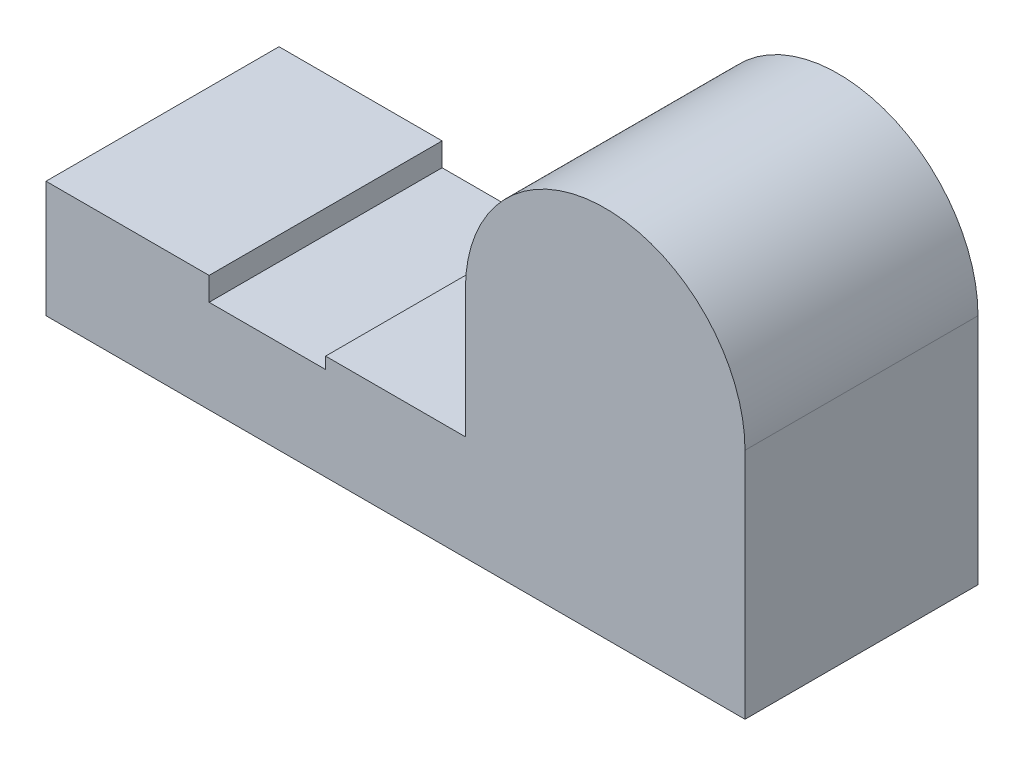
SolidWorks part; units mm, degrees
ref_plane "Front Plane" through (0, 0, 0) normal (0, 0, 1) x (1, 0, 0)
ref_plane "Top Plane" through (0, 0, 0) normal (0, 1, 0) x (1, 0, 0)
ref_plane "Right Plane" through (0, 0, 0) normal (1, 0, 0) x (0, 0, -1)
sketch "Sketch2" plane through (0, 0, 0) normal (0, 0, 1) x (1, 0, 0)
  line L0 (40, 0) -> (340, 0)
  line L1 (340, 0) -> (340, 100)
  line L2 (220, 100) -> (220, 45)
  line L3 (220, 45) -> (160, 45)
  line L4 (160, 45) -> (160, 40)
  line L5 (160, 40) -> (110, 40)
  line L6 (110, 40) -> (110, 50)
  line L7 (110, 50) -> (40, 50)
  line L8 (40, 50) -> (40, 0)
  line L9 (242.0826, 100) -> (317.1606, 100) construction
  line L10 (280, 143.381) -> (280, 78.0958) construction
  arc A0 (340, 100) -> (220, 100) centre (280, 100) ccw
  circle A1 centre (280, 100) radius 30
  dimension "D7" = 60
  dimension "D8" = 60
  dimension "D1" = 300
  dimension "D2" = 50
  dimension "D3" = 70
  dimension "D4" = 50
  dimension "D5" = 10
  dimension "D6" = 100
extrude "Boss-Extrude1" add sketch "Sketch2" along normal blind 100 contours L5 L6 L7 L8 L0 L1 A0 L2 L3 L4
equation "\"Length\"= \"D1@Sketch2\"'length of the model"
equation "\"D8@Sketch2\" = \"D1@Sketch2\" / 5'Radius"
equation "\"D7@Sketch2\" = \"D1@Sketch2\" / 5'Diameter"
equation "\"D2@Sketch2\" = \"D1@Sketch2\" / 6'Height"
equation "\"D6@Sketch2\" = \"D1@Sketch2\" / 3'Hole location"
equation "\"D3@Sketch2\" = \"D1@Sketch2\" / 30 * 7'Slot location"
equation "\"D4@Sketch2\" = \"D1@Sketch2\" / 6'Slot"
equation "\"D5@Sketch2\" = \"D1@Sketch2\" / 30'Slot depth"
equation "\"D1@Boss-Extrude1\" = \"D1@Sketch2\" / 3'Extrude"
